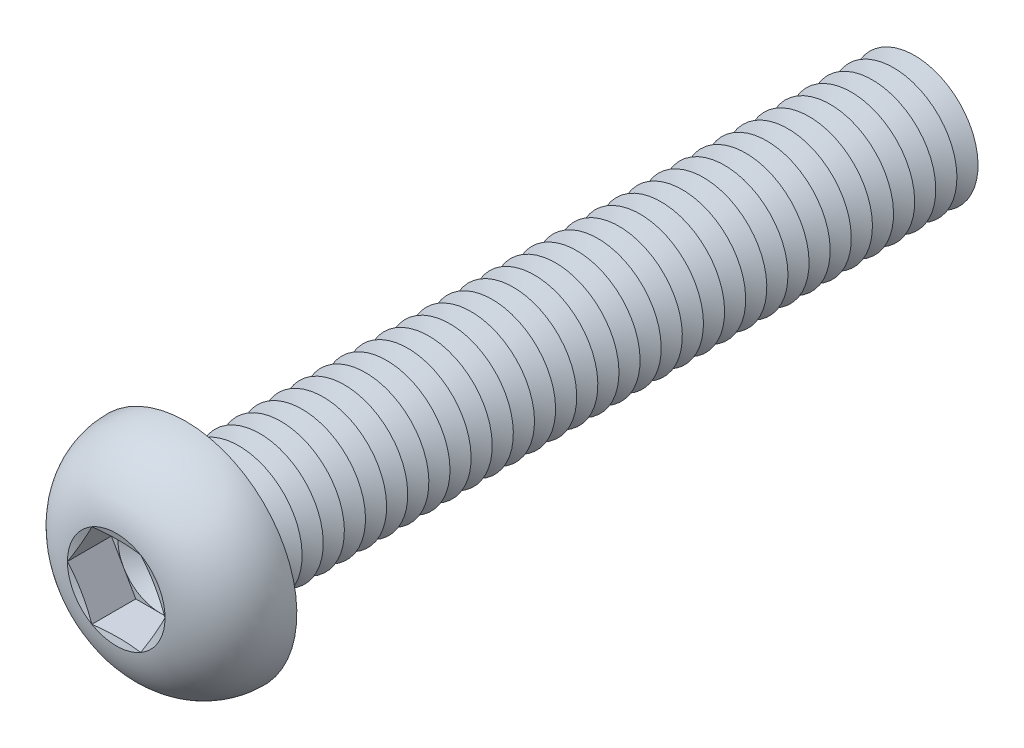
SolidWorks part; units mm, degrees
ref_plane "Front Plane" through (0, 0, 0) normal (0, 0, 1) x (1, 0, 0)
ref_plane "Top Plane" through (0, 0, 0) normal (0, 1, 0) x (1, 0, 0)
ref_plane "Right Plane" through (0, 0, 0) normal (1, 0, 0) x (0, 0, -1)
sketch "Sketch1" plane through (0, 0, 0) normal (1, 0, 0) x (0, 0, -1)
  line L0 (0, 3) -> (0, 5.25)
  line L3 (0, 3) -> (35, 3)
  line L4 (35, 3) -> (35, 0)
  line L5 (35, 0) -> (-3.3, 0) construction
  line L6 (-3.3, 0) -> (35, 0)
  line L7 (-3.3, 2.3094) -> (-3.3, 1.1547) construction
  line L8 (-3.3, 1.1547) -> (-3.3, 0)
  line L9 (-3.3, 2.3094) -> (-2.9906, 1.1547)
  line L10 (-2.9906, 1.1547) -> (-3.3, 1.1547)
  line L11 (35, 0) -> (22.7481, 0) construction
  line L12 (0, 5.25) -> (-3.3, 5.25) construction
  arc A1 (0, 5.25) -> (-3.3, 2.3094) centre (0, 1.928) ccw
  point P8 (35, 1.5)
  dimension "D1" = 10.5
  dimension "D2" = 6
  dimension "D3" = 3.3
  dimension "D4" = 4.6188
  dimension "D5" = 35
  dimension "D6" = 15
revolve "Revolve1" add sketch "Sketch1" angle 360 about L5
fillet "Fillet1" radius 0.5 1 edges at (0, 3, 0)
sketch "Sketch2" plane through (0, 0, 0) normal (1, 0, 0) x (0, 0, -1)
  line L0 (34.5, 3) -> (35.5, 3)
  line L1 (35, 3) -> (0.5, 3) construction
  line L2 (35.5, 3) -> (35, 2.134)
  line L3 (35, -3) -> (35, 3) construction
  line L4 (35, 2.134) -> (34.5, 3)
  dimension "D1" = 1
revolve "Cut-Revolve1" cut sketch "Sketch2" angle 360 about axis through (0, 0, -35) along (0, 0, -1)
pattern_linear "LPattern1" count 35 spacing 1 along (0, 0, 1) of "Cut-Revolve1"
sketch "Sketch3" plane through (0, 0, 3.3) normal (0, 0, 1) x (1, 0, 0)
  line L7 (1.1547, 2) -> (-1.1547, 2)
  line L8 (-1.1547, 2) -> (-2.3094, 0)
  line L9 (-2.3094, 0) -> (-1.1547, -2)
  line L10 (-1.1547, -2) -> (1.1547, -2)
  line L11 (1.1547, -2) -> (2.3094, 0)
  line L12 (2.3094, 0) -> (1.1547, 2)
  circle A0 centre (0, 0) radius 2 construction
  circle A3 centre (0, 0) radius 2.3094 construction
extrude "Cut-Extrude1" cut sketch "Sketch3" against normal blind 2.08
sketch "Sketch4" plane through (0, 0, 1.22) normal (0, 0, 1) x (1, 0, 0)
  line L1 (1.1547, 2) -> (-1.1547, 2) construction
  circle A0 centre (0, 0) radius 2
extrude "Cut-Extrude2" cut sketch "Sketch4" against normal through all draft 60
